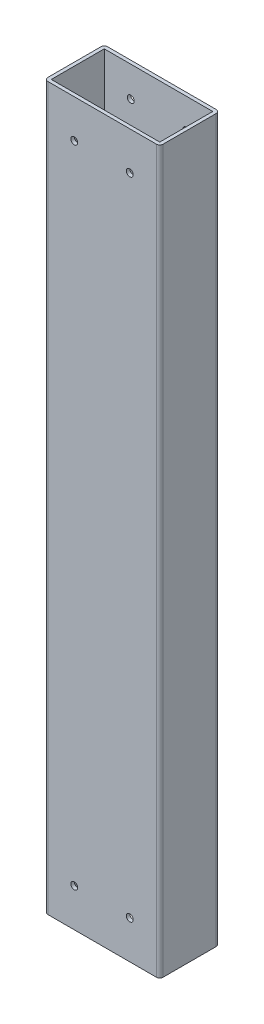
SolidWorks part; units mm, degrees
ref_plane "Front Plane" through (0, 0, 0) normal (0, 0, 1) x (1, 0, 0)
ref_plane "Top Plane" through (0, 0, 0) normal (0, 1, 0) x (1, 0, 0)
ref_plane "Right Plane" through (0, 0, 0) normal (1, 0, 0) x (0, 0, -1)
sketch "Sketch1" plane through (0, 0, 0) normal (0, 1, 0) x (1, 0, 0)
  line L1 (-24.8285, -13.716) -> (24.8285, -13.716)
  line L2 (-26.416, -12.1285) -> (-26.416, 12.1285)
  line L3 (-24.8285, 13.716) -> (24.8285, 13.716)
  line L4 (26.416, -12.1285) -> (26.416, 12.1285)
  line L5 (-26.416, -13.716) -> (26.416, 13.716) construction
  line L6 (-26.416, 13.716) -> (26.416, -13.716) construction
  arc A0 (-24.8285, -13.716) -> (-26.416, -12.1285) centre (-24.8285, -12.1285) cw
  arc A1 (24.8285, -13.716) -> (26.416, -12.1285) centre (24.8285, -12.1285) ccw
  arc A2 (24.8285, 13.716) -> (26.416, 12.1285) centre (24.8285, 12.1285) cw
  arc A3 (-26.416, 12.1285) -> (-24.8285, 13.716) centre (-24.8285, 12.1285) cw
  point P0 (0, 0)
  dimension "D3" = 1.5875
  dimension "D1" = 52.832
  dimension "D2" = 27.432
extrude "Extrude-Thin1" add sketch "Sketch1" along normal mid plane 330.2 thin
sketch "Sketch2" plane through (0, 0, 0) normal (0, 0, 1) x (1, 0, 0)
  line L0 (-12.7, 151.257) -> (12.7, 151.257) construction
  line L1 (-24.8285, 165.1) -> (24.8285, 165.1) construction
  line L2 (-24.8285, -165.1) -> (24.8285, -165.1) construction
  circle A0 centre (-12.7, 151.257) radius 1.5875
  circle A1 centre (12.7, 151.257) radius 1.5875
  circle A2 centre (12.7, -151.257) radius 1.5875
  circle A3 centre (-12.7, -151.257) radius 1.5875
  point P10 (0, 165.1)
  point P11 (0, 151.257)
  dimension "D1" = 2
  dimension "D3" = 3.175
  dimension "D4" = 13.843
  dimension "D5" = 13.843
  dimension "D6" = 25.4
  dimension "D2" = 2
extrude "Cut-Extrude1" cut sketch "Sketch2" against normal through all
sketch "Sketch3" plane through (0, 0, 0) normal (0, 0, 1) x (1, 0, 0)
  line L0 (12.7, -151.257) -> (12.7, -147.6375) construction
  circle A0 centre (12.7, -147.6375) radius 1.5875
  circle A1 centre (-12.7, -147.6375) radius 1.5875
  circle A2 centre (-12.7, 147.6375) radius 1.5875
  circle A3 centre (12.7, 147.6375) radius 1.5875
  circle A4 centre (12.7, -151.257) radius 1.5875 construction
  circle A6 centre (12.7, 151.257) radius 1.5875 construction
  dimension "D1" = 2
  dimension "D3" = 3.6195
  dimension "D4" = 3.6195
  dimension "D2" = 2
extrude "Cut-Extrude2" cut sketch "Sketch3" along normal through all
